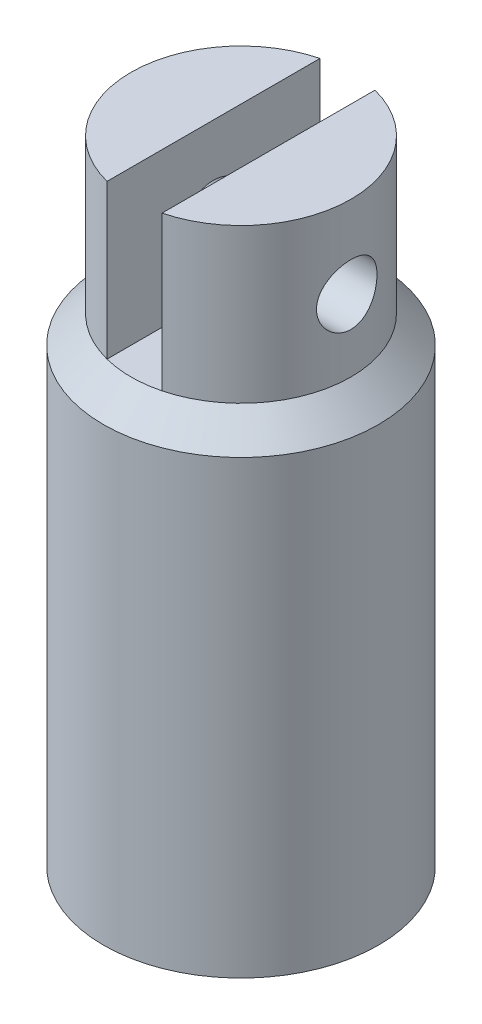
SolidWorks part; units mm, degrees
ref_plane "Front Plane" through (0, 0, 0) normal (0, 0, 1) x (1, 0, 0)
ref_plane "Top Plane" through (0, 0, 0) normal (0, 1, 0) x (1, 0, 0)
ref_plane "Right Plane" through (0, 0, 0) normal (1, 0, 0) x (0, 0, -1)
sketch "Sketch1" plane through (0, 0, 0) normal (0, 1, 0) x (1, 0, 0)
  circle A0 centre (0, 0) radius 2.5
  dimension "D1" = 5
extrude "Boss-Extrude1" add sketch "Sketch1" along normal mid plane 11.5
sketch "Sketch2" plane through (0, 5.75, 0) normal (0, 1, 0) x (1, 0, 0)
  circle A0 centre (0, 0) radius 2
  circle A1 centre (0, 0) radius 3
  dimension "D1" = 4
  dimension "D2" = 6
extrude "Cut-Extrude1" cut sketch "Sketch2" against normal blind 3.5
chamfer "Chamfer1" distance 0.7 angle 45 1 edges at (0, 2.25, 2)
sketch "Sketch3" plane through (0, 5.75, 0) normal (0, 1, 0) x (1, 0, 0)
  line L1 (-0.5, 2.5) -> (0.5, 2.5)
  line L2 (-0.5, 2.5) -> (-0.5, -2.5)
  line L3 (-0.5, -2.5) -> (0.5, -2.5)
  line L4 (0.5, 2.5) -> (0.5, -2.5)
  dimension "D1" = 1
  dimension "D2" = 0.5
  dimension "D3" = 5
  dimension "D4" = 2.5
extrude "Cut-Extrude2" cut sketch "Sketch3" against normal blind 2.8
sketch "Sketch4" plane through (-0.5, 0, 0) normal (1, 0, 0) x (0, 0, -1)
  line L0 (1.9365, 5.75) -> (-1.9365, 5.75) construction
  circle A0 centre (0, 4.25) radius 0.55
  dimension "D1" = 1.1
  dimension "D2" = 1.5
extrude "Cut-Extrude3" cut sketch "Sketch4" against normal through all both and the other way through all
